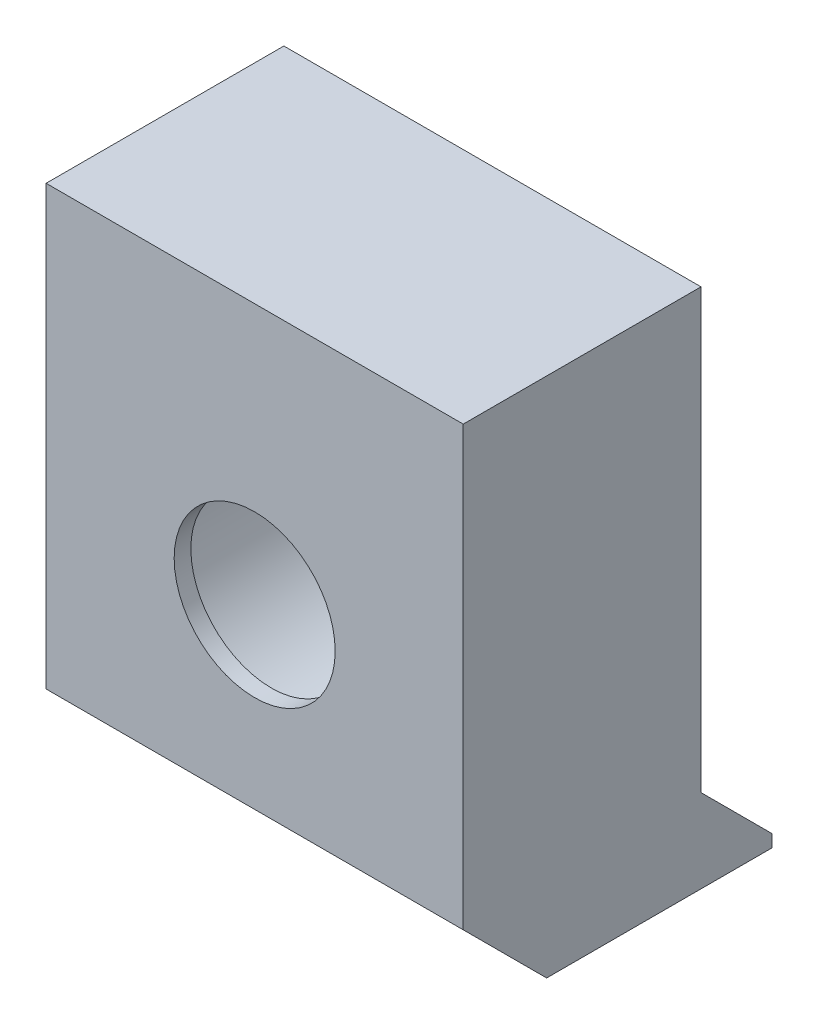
SolidWorks part; units mm, degrees
ref_plane "Front Plane" through (0, 0, 0) normal (0, 0, 1) x (1, 0, 0)
ref_plane "Top Plane" through (0, 0, 0) normal (0, 1, 0) x (1, 0, 0)
ref_plane "Right Plane" through (0, 0, 0) normal (1, 0, 0) x (0, 0, -1)
sketch "Sketch1" plane through (0, 0, 0) normal (0, 0, 1) x (1, 0, 0)
  line L0 (-12.7, 15.875) -> (12.7, 15.875)
  line L1 (12.7, 15.875) -> (12.7, -15.875)
  line L2 (12.7, -15.875) -> (-12.7, -15.875)
  line L3 (-12.7, -15.875) -> (-12.7, 15.875)
  line L4 (12.7, 15.875) -> (-12.7, -15.875) construction
  dimension "D1" = 25.4
  dimension "D2" = 31.75
extrude "Extrude1" add sketch "Sketch1" along normal blind 14.478
sketch "Sketch8" plane through (-12.7, 0, 0) normal (-1, 0, 0) x (0, 0, 1)
  line L0 (0, -10.795) -> (-5.08, -15.875)
  line L1 (0, 15.875) -> (0, -15.875) construction
  line L2 (-5.08, -15.875) -> (0, -15.875)
  line L3 (0, -15.875) -> (0, -10.795)
  dimension "D1" = 315
  dimension "D2" = 5.08
extrude "Extrude6" add sketch "Sketch8" against normal up to surface (25.4 mm away)
sketch "Sketch10" plane through (0, 0, 14.478) normal (0, 0, -1) x (-1, 0, 0)
  circle A0 centre (0, 0) radius 4.9022
  dimension "D1" = 9.8044
extrude "Extrude8" cut sketch "Sketch10" along normal through all
sketch "Sketch9" plane through (0, 0, 0) normal (0, 0, 1) x (1, 0, 0)
  circle A0 centre (0, 0) radius 7.9299
  dimension "D1" = 15.8598
extrude "Extrude7 BORE" cut sketch "Sketch9" along normal offset from surface (13.462 mm away) 1.016
sketch "Sketch11" [suppressed] plane through (0, 0, 11.43) normal (0, 0, 1) x (1, 0, 0)
  circle A0 centre (-27.94, 0) radius 6.3627
  dimension "D1" = 12.7254
  dimension "D2" = 27.94
extrude "Extrude9" [suppressed] cut sketch "Sketch11" against normal through all
mirror "Mirror1" [suppressed] about plane through (0, 0, 0) normal (1, 0, 0)
sketch "Sketch12" plane through (12.7, 0, 0) normal (1, 0, 0) x (0, 0, -1)
  line L0 (5.08, -15.875) -> (4.318, -15.875)
  line L1 (-14.478, -15.875) -> (5.08, -15.875) construction
  line L2 (4.318, -15.875) -> (4.318, -15.113)
  line L3 (5.08, -15.875) -> (0, -10.795) construction
  line L4 (4.318, -15.113) -> (5.08, -15.875)
  dimension "D1" = 0.762
extrude "Cut-Extrude1" cut sketch "Sketch12" against normal through all
sketch "Sketch14" plane through (0, 0, 11.303) normal (0, 0, -1) x (-1, 0, 0)
  line L0 (-12.7, 15.875) -> (12.7, 15.875) construction
  line L1 (13.4937, -15.875) -> (-13.4937, -15.875)
  line L2 (13.4937, -15.875) -> (13.4937, 15.875)
  line L3 (13.4937, 15.875) -> (-13.4937, 15.875)
  line L4 (-13.4937, -15.875) -> (-13.4937, 15.875)
  line L5 (12.7, -15.875) -> (-12.7, -15.875) construction
  line L6 (-13.4937, -15.875) -> (13.4937, 15.875) construction
  line L7 (12.7, 15.875) -> (12.7, -10.795) construction
  dimension "D1" = 0.7937
extrude "STOCK" [suppressed] add sketch "Sketch14" along normal up to surface (15.367 mm away) separate body
sketch "STOCK BOTTOM" plane through (0, 0, 14.478) normal (0, 0, 1) x (1, 0, 0)
  line L0 (-12.7, -15.875) -> (12.7, -15.875) construction
  line L1 (-13.4937, 15.875) -> (13.4937, 15.875)
  line L2 (-13.4937, 15.875) -> (-13.4937, -15.875)
  line L3 (-13.4937, -15.875) -> (13.4938, -15.875)
  line L4 (13.4937, 15.875) -> (13.4938, -15.875)
  line L5 (12.7, 15.875) -> (-12.7, 15.875) construction
  line L6 (13.4937, 15.875) -> (-13.4937, -15.875) construction
  dimension "D1" = 26.9875
sketch "STOCK TOP" plane through (0, 0, -4.318) normal (0, 0, 1) x (1, 0, 0)
  line L1 (-13.4937, 15.875) -> (13.4937, 15.875)
  line L2 (-13.4937, 15.875) -> (-13.4937, -15.875)
  line L3 (-13.4937, -15.875) -> (13.4938, -15.875)
  line L4 (13.4937, 15.875) -> (13.4938, -15.875)
  line L6 (13.4937, 15.875) -> (-13.4937, -15.875) construction
  line L7 (12.7, 15.875) -> (-12.7, 15.875) construction
  dimension "D1" = 26.9875
sketch "Sketch15" [suppressed] plane through (0, 0, 14.478) normal (0, 0, 1) x (1, 0, 0)
  circle A0 centre (0, 0) radius 9.5
  dimension "D1" = 19
ref_plane "Plane1" [suppressed] through (0, 0, 0) normal (0, 1, 0) x (-1, 0, 0)
chamfer "Chamfer1" distance 5.08 angle 45 1 edges at (0, -15.875, 14.478)
sketch "Sketch16" plane through (0, 0, 0) normal (0, 0, -1) x (-1, 0, 0)
  circle A0 centre (0, 0) radius 7.9502
  dimension "D1" = 15.9004
extrude "Cut-Extrude2" cut sketch "Sketch16" against normal blind 2.54
sketch "Sketch17" plane through (0, 0, 14.478) normal (0, 0, 1) x (1, 0, 0)
  line L0 (12.7, 15.875) -> (12.7, -15.875)
  line L1 (-12.7, 15.875) -> (-12.7, -15.875)
  line L2 (12.7, -15.875) -> (-12.7, -15.875) construction
  line L3 (12.7, -10.795) -> (12.7, -15.875) construction
